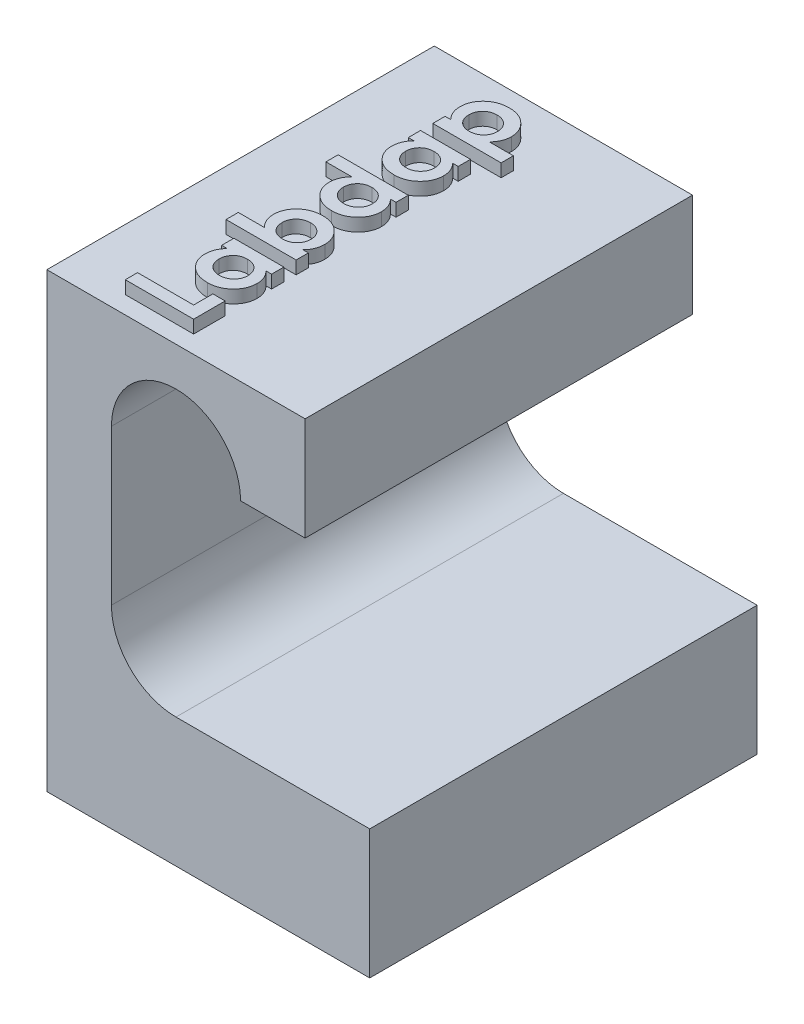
SolidWorks part; units mm, degrees
ref_plane "Plan de face" through (0, 0, 0) normal (0, 0, 1) x (1, 0, 0)
ref_plane "Plan de dessus" through (0, 0, 0) normal (0, 1, 0) x (1, 0, 0)
ref_plane "Plan de droite" through (0, 0, 0) normal (1, 0, 0) x (0, 0, -1)
sketch "Esquisse1" plane through (0, 0, 0) normal (0, 0, 1) x (1, 0, 0)
  line L7 (0, 0) -> (25, 0)
  line L8 (25, 0) -> (25, 10)
  line L9 (25, 10) -> (5, 10)
  line L10 (5, 10) -> (5, 32)
  line L11 (5, 32) -> (15, 32)
  line L12 (20, 27) -> (20, 35)
  line L13 (20, 35) -> (0, 35)
  line L14 (0, 35) -> (0, 0)
  line L16 (20, 27) -> (15, 27)
  line L17 (15, 27) -> (15, 32)
  point P4 (18.3303, 27.8303)
  point P14 (23.8471, 22.5015)
  dimension "D5" = 3
  dimension "D1" = 25
  dimension "D2" = 10
  dimension "D3" = 5
  dimension "D4" = 5
  dimension "D6" = 35
  dimension "D7" = 20
  dimension "D8" = 8
extrude "Boss.-Extru.1" add sketch "Esquisse1" along normal mid plane 30
fillet "Congé1" radius 5 3 edges at (15, 32, 0) (5, 32, 0) (5, 10, 0)
sketch "Esquisse2" plane through (5, 0, 0) normal (1, 0, 0) x (0, 0, -1)
  line L0 (-15, 15) -> (15, 27) construction
  circle A0 centre (0, 21) radius 5
  dimension "D1" = 10
extrude "Enlèv. mat.-Extru.1" cut sketch "Esquisse2" against normal through all
sketch "Esquisse3" plane through (0, 35, 0) normal (0, 1, 0) x (1, 0, 0)
  line L0 (10, -15) -> (10, 15) construction
  line L1 (20, -15) -> (0, -15) construction
  text T0 "<b>Labdap</b>" font "Century Gothic" height in points 20
extrude "Boss.-Extru.2" add sketch "Esquisse3" along normal blind 1
